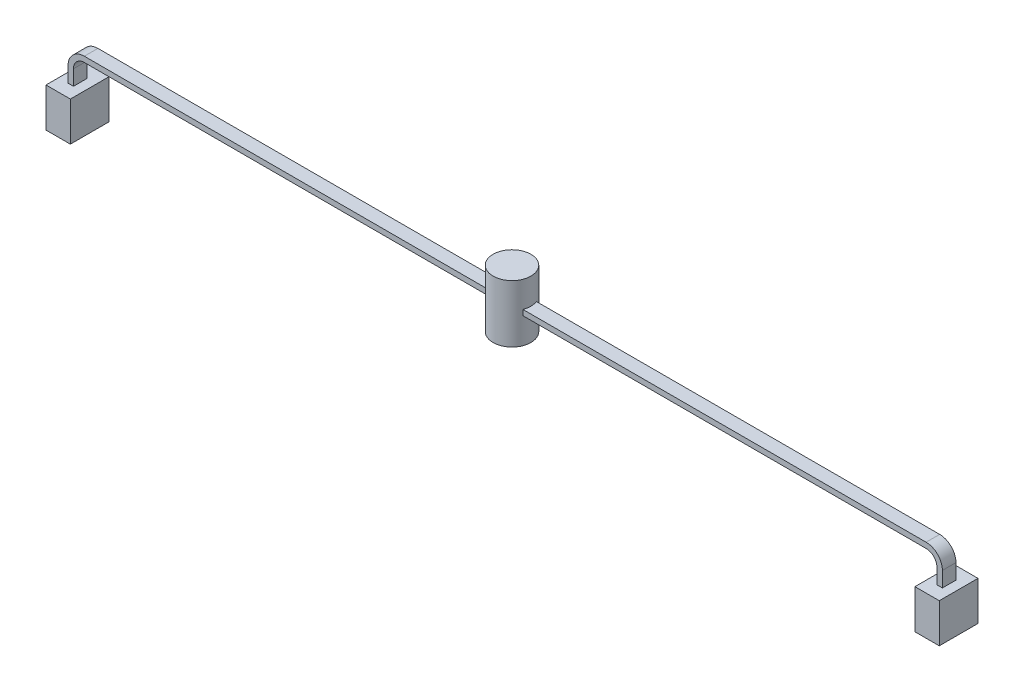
SolidWorks part; units mm, degrees
ref_plane "Front Plane" through (0, 0, 0) normal (0, 0, 1) x (1, 0, 0)
ref_plane "Top Plane" through (0, 0, 0) normal (0, 1, 0) x (1, 0, 0)
ref_plane "Right Plane" through (0, 0, 0) normal (1, 0, 0) x (0, 0, -1)
sketch "Sketch1" plane through (0, 0, 0) normal (0, 1, 0) x (1, 0, 0)
  circle A0 centre (0, 0) radius 8.8526
extrude "Extrude1" add sketch "Sketch1" along normal mid plane 26.924
sketch "Sketch5" plane through (0, 0, 0) normal (0, 0, 1) x (1, 0, 0)
  line L0 (0, 0) -> (196.85, 0)
  line L1 (203.2, -6.35) -> (203.2, -13.462)
  line L2 (-8.8526, -13.462) -> (8.8526, -13.462) construction
  arc A0 (196.85, 0) -> (203.2, -6.35) centre (196.85, -6.35) cw
  dimension "D1" = 6.35
  dimension "D2" = 203.2
extrude "Extrude-Thin1" add sketch "Sketch5" along normal mid plane 6.35 thin
sketch "Sketch6" plane through (0, -13.462, 0) normal (0, -1, 0) x (1, 0, 0)
  line L0 (203.2, 3.175) -> (203.2, 9.057) construction
  line L1 (197.5055, 9.057) -> (208.8945, 9.057)
  line L2 (197.5055, 9.057) -> (197.5055, -9.057)
  line L3 (197.5055, -9.057) -> (208.8945, -9.057)
  line L4 (208.8945, 9.057) -> (208.8945, -9.057)
  line L5 (204.47, 3.175) -> (201.93, 3.175) construction
  line L6 (204.47, 0) -> (208.8945, 0) construction
  line L7 (204.47, 3.175) -> (204.47, -3.175) construction
extrude "Extrude3" add sketch "Sketch6" along normal blind 18.288
mirror "Mirror1" about plane through (0, 0, 0) normal (1, 0, 0) of "Extrude3", "Extrude-Thin1"
